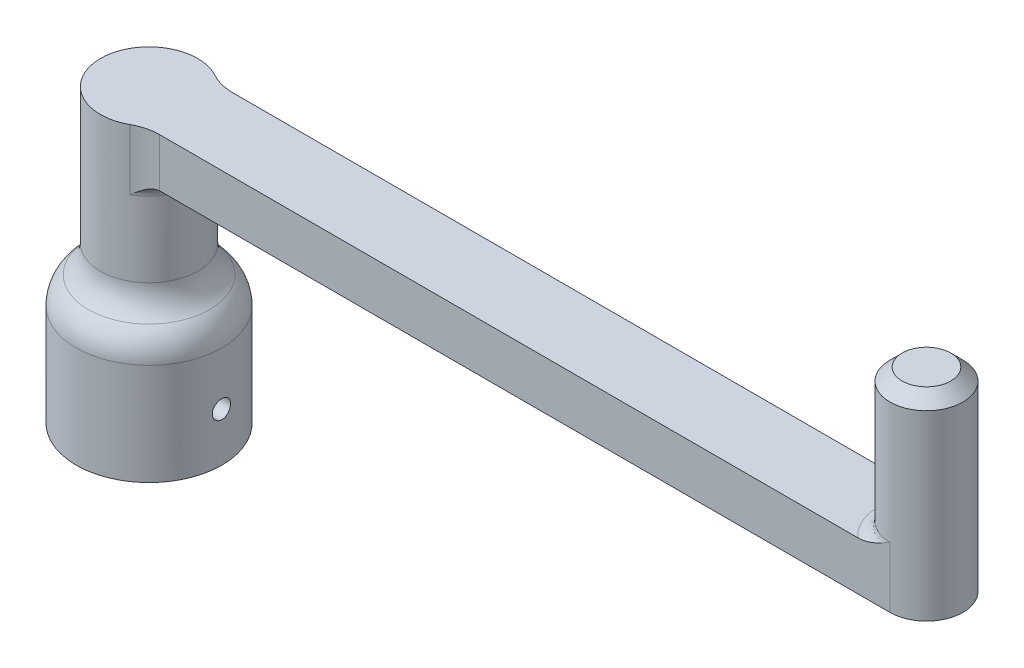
SolidWorks part; units mm, degrees
ref_plane "Front" through (0, 0, 0) normal (0, 0, 1) x (1, 0, 0)
ref_plane "Top" through (0, 0, 0) normal (0, 1, 0) x (-1, 0, 0)
ref_plane "Right" through (0, 0, 0) normal (1, 0, 0) x (0, 0, -1)
sketch "Sketch1" plane through (0, 0, 0) normal (0, 1, 0) x (-1, 0, 0)
  circle A0 centre (0, 0) radius 6.35
  dimension "D1" = 12.7
extrude "Base-Extrude" add sketch "Sketch1" along normal blind 38.1
sketch "Sketch3" plane through (0, 0, 0) normal (0, 1, 0) x (-1, 0, 0)
  circle A1 centre (0, 0) radius 9.525
  circle A2 centre (0, 0) radius 9.525
  dimension "D1" = 3.175
extrude "Boss-Extrude1" add sketch "Sketch3" along normal blind 15.875
sketch "Sketch4" plane through (0, 0, 0) normal (0, 1, 0) x (-1, 0, 0)
  line L0 (-4.7625, 4.2001) -> (-4.7625, -4.2001)
  circle A0 centre (0, 0) radius 6.35 construction
  arc A1 (-4.7625, -4.2001) -> (-4.7625, 4.2001) centre (0, 0) ccw
  dimension "D1" = 1.5875
extrude "Cut-Extrude1" cut sketch "Sketch4" along normal blind 12.7
fillet "Fillet1" radius 4.7625 1 edges at (0, 15.875, 6.35)
fillet "Fillet2" radius 4.7625 1 edges at (0, 15.875, 9.525)
sketch "Sketch5" plane through (4.7625, 0, 0) normal (-1, 0, 0) x (0, 0, 1)
  line L0 (4.2001, 0) -> (-4.2001, 0) construction
  circle A0 centre (0, 6.35) radius 1.1906
  dimension "D2" = 2.3813
  dimension "D1" = 6.35
extrude "Cut-Extrude2" cut sketch "Sketch5" against normal through all
sketch "Sketch6" plane through (0, 38.1, 0) normal (0, 1, 0) x (-1, 0, 0)
  line L0 (0, 0) -> (-101.6, 0) construction
  line L1 (0, -4.7625) -> (-101.6, -4.7625)
  line L2 (0, 4.7625) -> (-101.6, 4.7625)
  line L4 (0, 4.7625) -> (0, -4.7625)
  arc A0 (-101.6, 4.7625) -> (-101.6, -4.7625) centre (-101.6, 0) ccw
  dimension "D1" = 101.6
  dimension "D2" = 9.525
extrude "Boss-Extrude2" add sketch "Sketch6" against normal blind 6.35
fillet "Fillet3" radius 6.35 2 edges at (4.2001, 34.925, -4.7625) (4.2001, 34.925, 4.7625)
sketch "Sketch7" plane through (0, 38.1, 0) normal (0, 1, 0) x (-1, 0, 0)
  circle A0 centre (-101.6, 0) radius 4.7625
  arc A1 (-101.6, 4.7625) -> (-101.6, -4.7625) centre (-101.6, 0) ccw construction
extrude "Boss-Extrude3" add sketch "Sketch7" along normal blind 19.05
chamfer "Chamfer1" distance 1.5875 angle 45 1 edges at (101.6, 57.15, 4.7625)
fillet "Fillet5" radius 1.5875 4 edges at (6.35, 31.75, 0) (4.5609, 31.75, 4.9641) (4.5609, 31.75, -4.9641)
